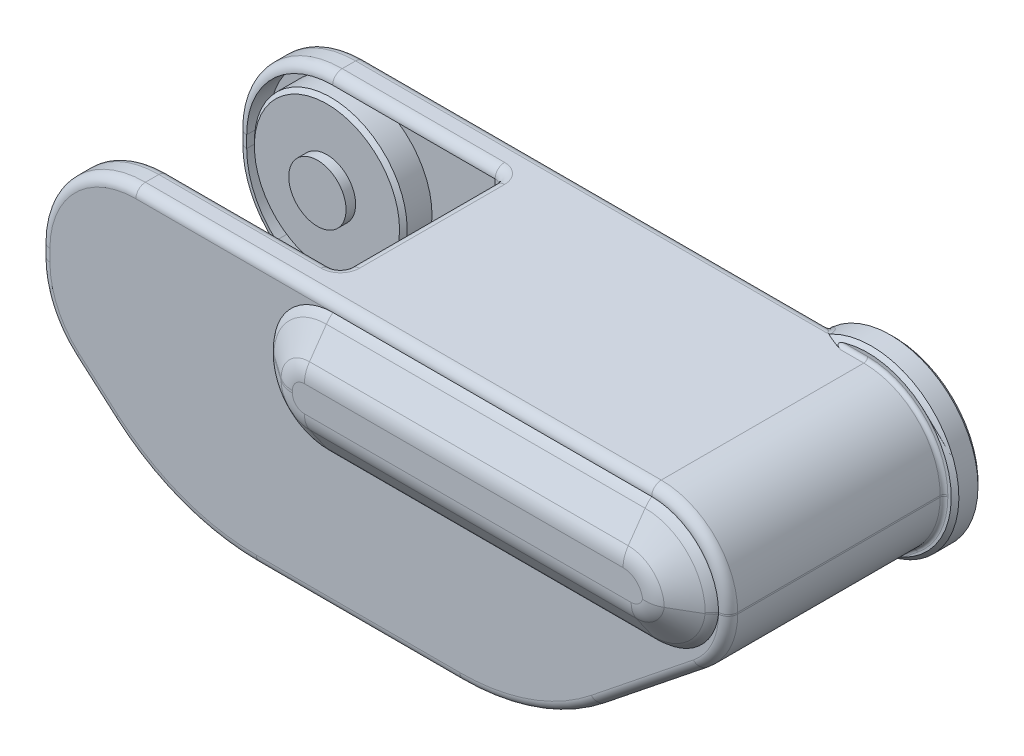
SolidWorks part; units mm, degrees
ref_plane "Ön Düzlem" through (0, 0, 0) normal (0, 0, 1) x (1, 0, 0)
ref_plane "Üst Düzlem" through (0, 0, 0) normal (0, 1, 0) x (1, 0, 0)
ref_plane "Sağ Düzlem" through (0, 0, 0) normal (1, 0, 0) x (0, 0, -1)
sketch "Çizim1" plane through (0, 0, 0) normal (0, 0, 1) x (1, 0, 0)
  line L1 (0, 0) -> (100, 0)
  line L2 (100, 0) -> (200, 80)
  line L3 (200, 80) -> (200, 140)
  line L4 (200, 140) -> (0, 140)
  line L5 (0, 0) -> (-90, 0)
  line L6 (-90, 0) -> (-160, 61)
  line L7 (-160, 61) -> (-160, 140)
  line L8 (-160, 140) -> (0, 140)
  dimension "D1" = 200
  dimension "D2" = 140
  dimension "D3" = 100
  dimension "D4" = 90
  dimension "D5" = 79
  dimension "D6" = 60
  dimension "D7" = 160
extrude "Yükseklik-Ekstrüzyon1" add sketch "Çizim1" along normal blind 120
fillet "Radyus1" radius 50 2 edges at (-160, 61, 60) (-160, 140, 60)
fillet "Radyus2" radius 40 2 edges at (200, 80, 60) (200, 140, 60)
fillet "Radyus3" radius 5 20 edges at (5, 0, 120) (-116.4245, 23.027, 120) (-155.5107, 63.0426, 120) (-160, 86.8748, 120) (-145.3553, 125.3553, 120) (25, 140, 120) (188.2843, 128.2843, 120) (200, 99.6125, 120) (196.0521, 81.8974, 120) (142.4939, 33.9951, 120) (188.2843, 128.2843, 0) (25, 140, 0) (-145.3553, 125.3553, 0) (-160, 86.8748, 0) (-155.5107, 63.0426, 0) (-116.4245, 23.027, 0) (5, 0, 0) (142.4939, 33.9951, 0) (196.0521, 81.8974, 0) (200, 99.6125, 0)
fillet "Radyus4" radius 115 6 edges at (-89.4514, 1.4645, 1.4645) (-89.4514, 1.4645, 118.5355) (99.4863, 1.4645, 1.4645) (99.4863, 1.4645, 118.5355) (100, 0, 60) (-90, 0, 60)
sketch "Çizim2" plane through (0, 140, 0) normal (0, 1, 0) x (1, 0, 0)
  line L0 (0, 0) -> (0, -30) construction
  line L1 (160, -120) -> (-110, -120) construction
  line L2 (0, -120) -> (0, -170) construction
  line L3 (-20, -100) -> (-277.8581, -100) construction
  line L4 (-110, 0) -> (160, 0) construction
  line L5 (-20, -103) -> (-262.2649, -103)
  line L7 (-20, -17) -> (-262.2649, -17)
  line L8 (-262.2649, -103) -> (-262.2649, -17)
  line L9 (-20, -92.0366) -> (-262.2649, -17) construction
  line L10 (-20, -107.9634) -> (-262.2649, -103) construction
  line L12 (-20, -17) -> (-20, -103)
  line L13 (0, -170) -> (0, -120) construction
  dimension "D1" = 17
  dimension "D2" = 20
  dimension "D3" = 17
extrude "Kes-Ekstrüzyon1" cut sketch "Çizim2" against normal blind 200
fillet "Radyus5" radius 5 18 edges at (-20, 0, 60) (-33.4617, 0, 103) (-33.4617, 0, 17) (-87.2629, 7.3073, 103) (-87.2629, 7.3073, 17) (-132.6624, 37.1772, 103) (-132.6624, 37.1772, 17) (-155.5107, 63.0426, 103) (-155.5107, 63.0426, 17) (-160, 86.8748, 103) (-160, 86.8748, 17) (-145.3553, 125.3553, 103) (-145.3553, 125.3553, 17) (-65, 140, 103) (-65, 140, 17) (-20, 140, 60) (-20, 70, 103) (-20, 70, 17)
shell "İç Boşaltma1" thickness 5
sketch "Çizim3" plane through (0, 0, 5) normal (0, 0, 1) x (1, 0, 0)
  circle A0 centre (-110, 90) radius 40
extrude "Yükseklik-Ekstrüzyon2" add sketch "Çizim3" along normal blind 15
chamfer "Pah1" distance 2 angle 45 1 edges at (-70, 90, 20)
sketch "Çizim4" plane through (0, 0, 20) normal (0, 0, 1) x (1, 0, 0)
  circle A0 centre (-110, 90) radius 15
  dimension "D1" = 30
extrude "Yükseklik-Ekstrüzyon3" add sketch "Çizim4" along normal blind 5
ref_plane "Düzlem1" through (0, 0, 60) normal (0, 0, 1) x (1, 0, 0)
mirror "Aynalama1" about plane through (0, 0, 60) normal (0, 0, 1) of "Pah1", "Yükseklik-Ekstrüzyon2", "Yükseklik-Ekstrüzyon3"
sketch "Çizim5" plane through (0, 0, 120) normal (0, 0, 1) x (1, 0, 0)
  line L0 (181.8643, 71.8946) -> (-37.8249, 71.8946)
  line L1 (-37.8249, 71.8946) -> (-37.8249, 135)
  line L6 (-46.9234, 5) -> (59.6602, 5)
  line L7 (128.3766, 29.1044) -> (181.8643, 71.8946)
  line L8 (195, 99.225) -> (195, 100)
  line L9 (160, 135) -> (-110, 135)
  line L10 (-155, 90) -> (-155, 83.7495)
  line L12 (-46.9234, 5) -> (59.6602, 5)
  line L13 (128.3766, 29.1044) -> (181.8643, 71.8946)
  line L14 (195, 99.225) -> (195, 100)
  line L15 (160, 135) -> (-110, 135)
  line L20 (-155, 90) -> (-155, 83.7495)
  line L21 (-139.564, 49.8236) -> (-119.191, 32.07)
  line L22 (-139.564, 49.8236) -> (-119.191, 32.07)
  arc A6 (-119.191, 32.07) -> (-46.9234, 5) centre (-46.9234, 115) ccw
  arc A7 (59.6602, 5) -> (128.3766, 29.1044) centre (59.6602, 115) ccw
  arc A8 (181.8643, 71.8946) -> (195, 99.225) centre (160, 99.225) ccw
  arc A9 (195, 100) -> (160, 135) centre (160, 100) ccw
  arc A10 (-119.191, 32.07) -> (-46.9234, 5) centre (-46.9234, 115) ccw
  arc A11 (-110, 135) -> (-155, 90) centre (-110, 90) ccw
  arc A13 (59.6602, 5) -> (128.3766, 29.1044) centre (59.6602, 115) ccw
  arc A14 (181.8643, 71.8946) -> (195, 99.225) centre (160, 99.225) ccw
  arc A15 (195, 100) -> (160, 135) centre (160, 100) ccw
  arc A18 (-110, 135) -> (-155, 90) centre (-110, 90) ccw
  arc A19 (-155, 83.7495) -> (-139.564, 49.8236) centre (-110, 83.7495) ccw
  arc A20 (-155, 83.7495) -> (-139.564, 49.8236) centre (-110, 83.7495) ccw
  dimension "D1" = 0
extrude "Yükseklik-Ekstrüzyon4" add sketch "Çizim5" along normal blind 15 contours L1 L0 M17 M18 M19 M20
fillet "Radyus6" radius 31 2 edges at (-37.8249, 71.8946, 127.5) (-37.8249, 135, 127.5)
fillet "Radyus7" radius 31 1 edges at (181.8643, 71.8946, 127.5)
chamfer "Pah2" distance 14 distance2 20 8 edges at (184.8, 79.7132, 135) (78.6965, 71.8946, 135) (184.7487, 124.7487, 135) (-28.7452, 80.9743, 135) (76.5876, 135, 135) (-37.8249, 103.4473, 135) (-28.7452, 125.9203, 135) (195, 99.6125, 135)
fillet "Radyus9" radius 15 7 edges at (171.1564, 94.3589, 135) (78.6965, 91.8946, 135) (-14.603, 95.1164, 135) (-17.8249, 103.4473, 135) (170.3751, 110.8331, 135) (-14.603, 111.7782, 135) (76.5876, 115, 135)
fillet "Radyus10" radius 15 8 edges at (184.7668, 79.6837, 121) (78.6965, 71.8946, 121) (-28.7452, 80.9743, 121) (184.7487, 124.7487, 121) (-37.8249, 103.4473, 121) (76.5876, 135, 121) (-28.7452, 125.9203, 121)
sketch "Çizim6" plane through (0, 0, 0) normal (0, 0, -1) x (-1, 0, 0)
  circle A0 centre (-160, 100) radius 45.7865
extrude "Yükseklik-Ekstrüzyon5" add sketch "Çizim6" against normal blind 7
sketch "Çizim7" plane through (0, 0, 0) normal (0, 0, -1) x (-1, 0, 0)
  circle A0 centre (-160, 100) radius 45.7865
extrude "Yükseklik-Ekstrüzyon6" add sketch "Çizim7" along normal blind 7
sketch "Çizim8" plane through (0, 0, -7) normal (0, 0, -1) x (-1, 0, 0)
  circle A0 centre (-160, 100) radius 20
  dimension "D1" = 40
extrude "Kes-Ekstrüzyon2" cut sketch "Çizim8" against normal blind 6
chamfer "Pah4" distance 2 angle 45 2 edges at (114.2135, 100, -7) (202.9901, 115.7561, 7)
fillet "Radyus13" radius 4 3 edges at (168.169, 54.9481, 3.2336) (136.9557, 139.5647, 2.9594) (116.9542, 84.3967, 0)
fillet "Radyus14" radius 2 5 edges at (178.7795, 63.0236, 7) (196.0521, 81.8974, 7) (200, 99.6125, 7) (188.2843, 128.2843, 7) (151.0941, 140, 7)
sketch "Çizim9" plane through (0, 0, 25) normal (0, 0, 1) x (1, 0, 0)
  line L0 (-72.5885, 75.8443) -> (-25.797, 199.5077)
  line L1 (-25.797, 199.5077) -> (426.1173, 199.5077)
  line L2 (426.1173, 199.5077) -> (426.1173, 263.2175)
  line L3 (426.1173, 263.2175) -> (-104.721, 291.005)
  line L5 (-148.9781, 98.9837) -> (-104.721, 291.005)
  circle A0 centre (-110, 90) radius 40
  dimension "D1" = 80
  dimension "D2" = 192.0213
  dimension "D3" = 99.982
